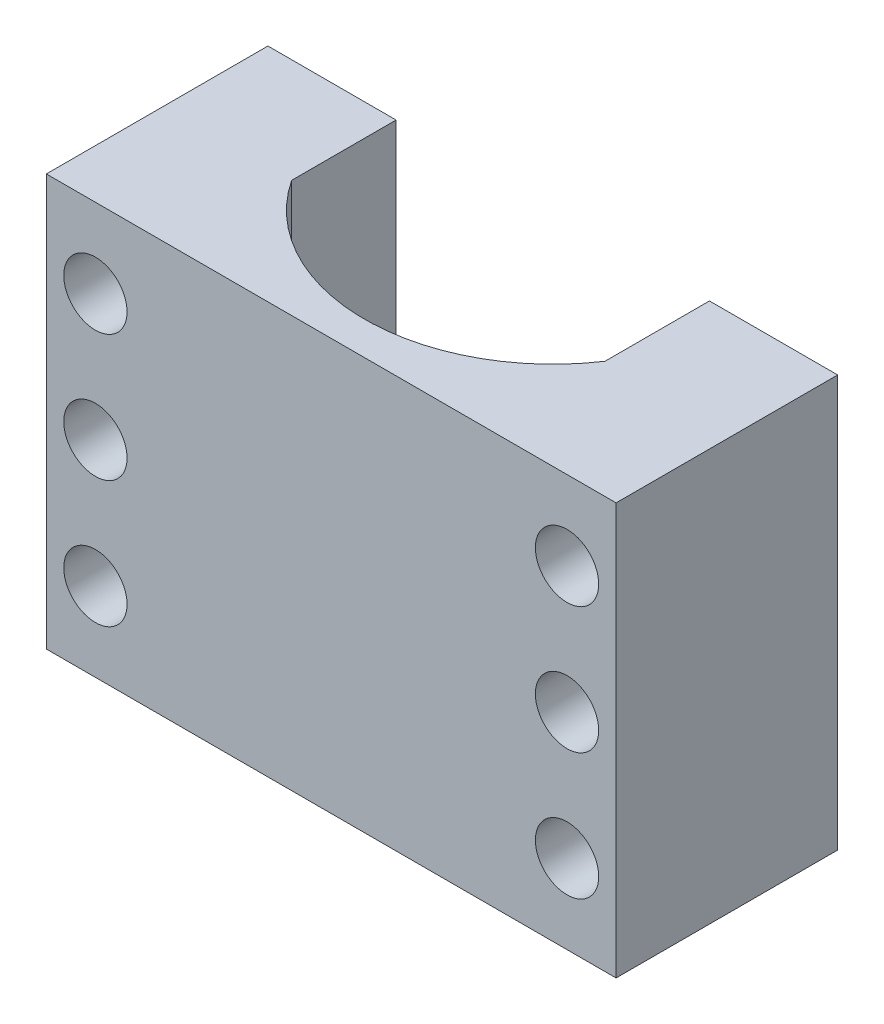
SolidWorks part; units mm, degrees
ref_plane "前视基准面" through (0, 0, 0) normal (0, 0, 1) x (1, 0, 0)
ref_plane "上视基准面" through (0, 0, 0) normal (0, 1, 0) x (1, 0, 0)
ref_plane "右视基准面" through (0, 0, 0) normal (1, 0, 0) x (0, 0, -1)
sketch "草图1" plane through (0, 0, 0) normal (0, 0, 1) x (1, 0, 0)
  line L1 (-9, -6.5) -> (9, -6.5)
  line L2 (-9, -6.5) -> (-9, 6.5)
  line L3 (-9, 6.5) -> (9, 6.5)
  line L4 (9, -6.5) -> (9, 6.5)
  line L5 (-9, -6.5) -> (9, 6.5) construction
  line L6 (-9, 6.5) -> (9, -6.5) construction
  line L7 (-5.95, -6.5) -> (5.95, -6.5)
  line L8 (-5.95, -6.5) -> (-5.95, 6.5)
  line L9 (-5.95, 6.5) -> (5.95, 6.5)
  line L10 (5.95, -6.5) -> (5.95, 6.5)
  line L11 (-5.95, -6.5) -> (5.95, 6.5) construction
  line L12 (-5.95, 6.5) -> (5.95, -6.5) construction
  circle A0 centre (-7.45, 4) radius 1
  point P0 (0, 0)
  point P6 (0, 0)
  dimension "D3" = 2
  dimension "D5" = 2.5
  dimension "D1" = 11.9
  dimension "D2" = 18
  dimension "D4" = 1.5
  dimension "D6" = 13
extrude "凸台-拉伸1" add sketch "草图1" along normal blind 14 contours L1 L8 L3 L2 A0 | L1 L10 L3 L8 | L10 L1 L4 L3 | A0
sketch "草图2" plane through (0, 0, 14) normal (0, 0, 1) x (1, 0, 0)
  line L0 (55, 0) -> (-55, 0) construction
  line L1 (0, -55) -> (0, 55) construction
  line L2 (-7.45, 0) -> (0, 0) construction
  circle A0 centre (-7.45, 4) radius 1 construction
  circle A1 centre (-7.45, 4) radius 1
  circle A2 centre (-7.45, -4) radius 1
  circle A3 centre (7.45, -4) radius 1
  circle A4 centre (7.45, 4) radius 1
  circle A5 centre (-7.45, 0) radius 1
  circle A6 centre (7.45, 0) radius 1
  point P15 (0, 0)
extrude "切除-拉伸1" cut sketch "草图2" against normal through all
sketch "草图4" plane through (0, 6.5, 0) normal (0, 1, 0) x (1, 0, 0)
  line L0 (-9, -7) -> (0, -7) construction
  line L1 (-9, -14) -> (-9, 0) construction
  line L2 (0, -7) -> (0, 0) construction
  line L4 (4.95, -11.95) -> (-4.95, -11.95)
  line L5 (4.95, -11.95) -> (4.95, -2.05)
  line L6 (4.95, -2.05) -> (-4.95, -2.05)
  line L7 (-4.95, -11.95) -> (-4.95, -2.05)
  line L8 (4.95, -11.95) -> (-4.95, -2.05) construction
  line L9 (4.95, -2.05) -> (-4.95, -11.95) construction
  circle A0 centre (0, -7) radius 5.95
  dimension "D1" = 11.9
  dimension "D2" = 9.9
extrude "切除-拉伸2" cut sketch "草图4" against normal through all contours L4 A0 L5 L6 L7 | L6 A0 | L4 A0
sketch "草图5" plane through (0, 0, 0) normal (0, 0, -1) x (-1, 0, 0)
  line L1 (-9, -6.5) -> (9, -6.5)
  line L2 (-9, -6.5) -> (-9, 6.5)
  line L3 (-9, 6.5) -> (9, 6.5)
  line L4 (9, -6.5) -> (9, 6.5)
  line L5 (-9, -6.5) -> (9, 6.5) construction
  line L6 (-9, 6.5) -> (9, -6.5) construction
  point P0 (0, 0)
extrude "切除-拉伸3" cut sketch "草图5" against normal blind 7
